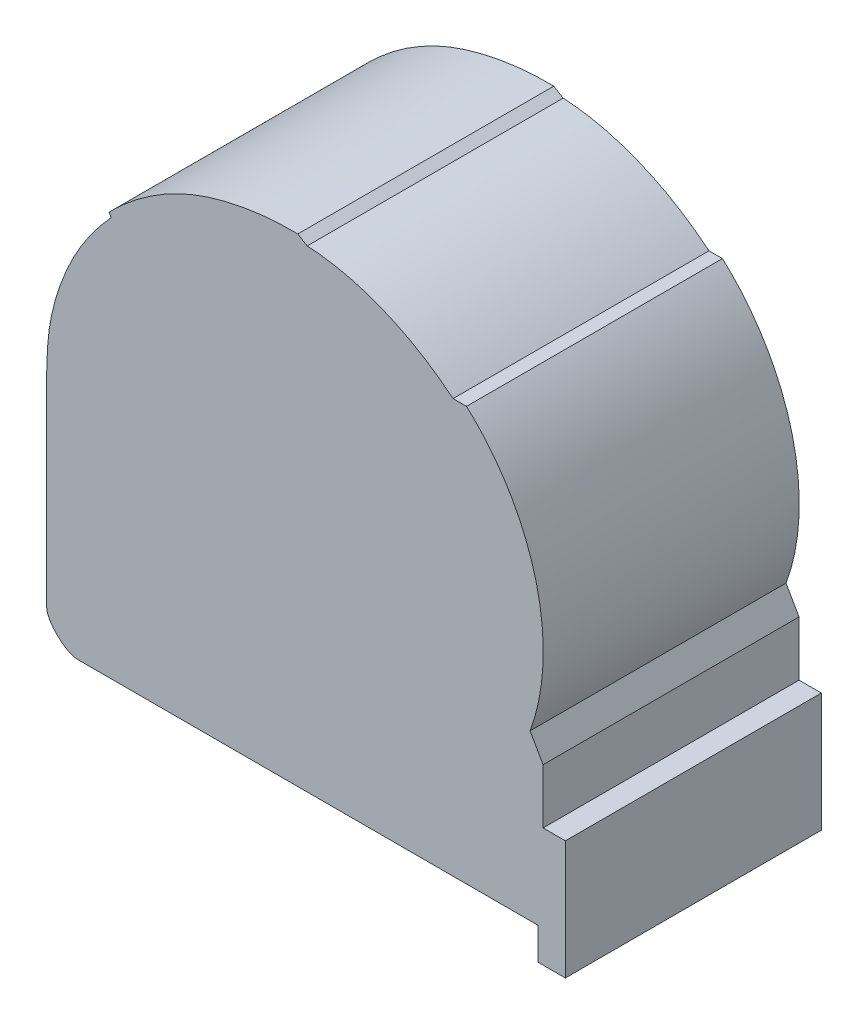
SolidWorks part; units mm, degrees
ref_plane "Plan de face" through (0, 0, 0) normal (0, 0, 1) x (1, 0, 0)
ref_plane "Plan de dessus" through (0, 0, 0) normal (0, 1, 0) x (1, 0, 0)
ref_plane "Plan de droite" through (0, 0, 0) normal (1, 0, 0) x (0, 0, -1)
sketch "Esquisse1" plane through (0, 0, 0) normal (0, 0, 1) x (1, 0, 0)
  line L0 (58.7581, -82.978) -> (-19.2841, -83.6591) construction
  line L1 (0, 0) -> (81.7358, 0) construction
  line L2 (0, 0) -> (59.2962, 0)
  line L3 (59.2962, 0) -> (59.2962, -4.1248)
  line L4 (59.2962, -4.1248) -> (62.7962, -4.1248)
  line L5 (62.7962, -4.1248) -> (62.7962, 11.1931)
  line L6 (62.7962, 11.1931) -> (59.9257, 11.1931)
  line L7 (59.9257, 11.1931) -> (59.9257, 18.2575)
  line L8 (59.9257, 18.2575) -> (58.247, 21.1951)
  line L9 (50.0512, 53.3278) -> (48.3164, 53.3278)
  line L10 (29.512, 60.9726) -> (28.3004, 61.7026)
  line L11 (3.9763, 51.9747) -> (4.2452, 51.5042)
  line L12 (-4.0743, 3.883) -> (-4.0743, 27.5041)
  spline S0 degree 3 poles (58.247, 21.1951) (59.7341, 25.2059) (61.0734, 37.112) (55.5968, 48.2944) (50.0512, 53.3278) knots 0 0 0 0 0.366434 1 1 1 1
  spline S1 degree 3 poles (48.3164, 53.3278) (43.0192, 57.6663) (36.4104, 60.6074) (29.512, 60.9726) knots 0 0 0 0 1 1 1 1
  spline S2 degree 3 poles (28.3004, 61.7026) (25.3952, 61.7657) (20.6959, 61.271) (12.0639, 58.6473) (6.9468, 55.0591) (3.9763, 51.9747) knots 0 0 0 0 0.323379 0.522176 1 1 1 1
  spline S3 degree 3 poles (4.2452, 51.5042) (2.4718, 49.5738) (-0.2608, 45.8505) (-2.6023, 40.2801) (-4.1062, 34.3644) (-4.0826, 30.1849) (-4.0743, 27.5041) knots 0 0 0 0 0.301499 0.525502 0.690337 1 1 1 1
  spline S4 degree 3 poles (-4.0743, 3.883) (-4.0743, 3.2545) (-3.4654, 2.1469) (-2.1205, 0.7623) (-0.8457, 0) (0, 0) knots 0 0 0 0 0.322036 0.577642 1 1 1 1
  point P32 (-3.3713, 2.3871)
  point P36 (-2.1994, 1.0839)
  point P38 (-3.3432, 2.1152)
  point P39 (-2.2932, 1.0183)
  dimension "D1" = 64
  dimension "D2" = 3.5
extrude "Boss.-Extru.1" add sketch "Esquisse1" along normal blind 33
sketch "Esquisse2" plane through (0, 0, 0) normal (0, 0, -1) x (-1, 0, 0)
  line L0 (4.0743, 27.5041) -> (4.0743, 3.883) construction
  line L1 (-11.9257, 9) -> (-33.9257, 9)
  line L2 (-11.9257, 9) -> (-11.9257, 46)
  line L3 (-11.9257, 46) -> (-33.9257, 46)
  line L4 (-33.9257, 9) -> (-33.9257, 46)
  line L5 (0, 0) -> (-59.2962, 0) construction
  dimension "D1" = 16
  dimension "D2" = 9
  dimension "D3" = 22
  dimension "D4" = 37
extrude "Boss.-Extru.2" add sketch "Esquisse2" along normal blind 7
